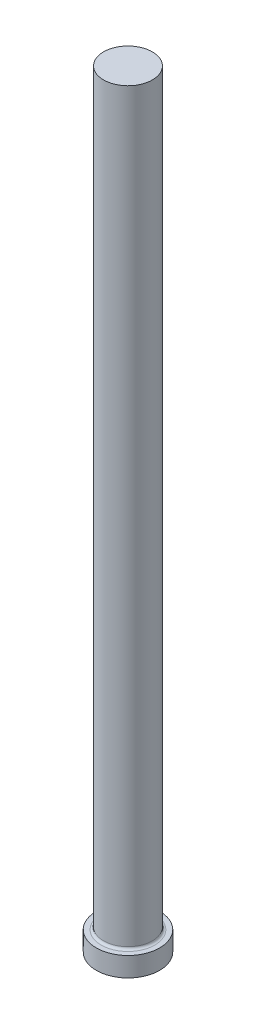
SolidWorks part; units mm, degrees
ref_plane "Plano frontal" through (0, 0, 0) normal (0, 0, 1) x (1, 0, 0)
ref_plane "Plano superior" through (0, 0, 0) normal (0, 1, 0) x (1, 0, 0)
ref_plane "Plano direito" through (0, 0, 0) normal (1, 0, 0) x (0, 0, -1)
sketch "Esboço1" plane through (0, 0, 0) normal (0, 0, 1) x (1, 0, 0)
  line L0 (0, 0) -> (13, 0)
  line L1 (13, 0) -> (13, 8)
  line L2 (13, 8) -> (11, 8)
  line L3 (10, 9) -> (10, 315)
  line L4 (10, 315) -> (0, 315)
  line L5 (0, 315) -> (0, 0) construction
  line L6 (0, 0) -> (0, 315)
  arc A0 (11, 8) -> (10, 9) centre (11, 9) cw
  dimension "D3" = 1
  dimension "D1" = 26
  dimension "D2" = 20
  dimension "D4" = 8
  dimension "D5" = 315
revolve "Revolução1" add sketch "Esboço1" angle 360 about L5
sketch "Esboço2"
  dimension "D1" = 0.975
  dimension "D2" = 2.275
  dimension "D3" = 1.4625
  dimension "D4" = 6.9875
wrap "Envolver1" sketch "Esboço2" wrap type deboss source sketch "Esboço2" thickness 0.1 parameters "D1"=0.1
